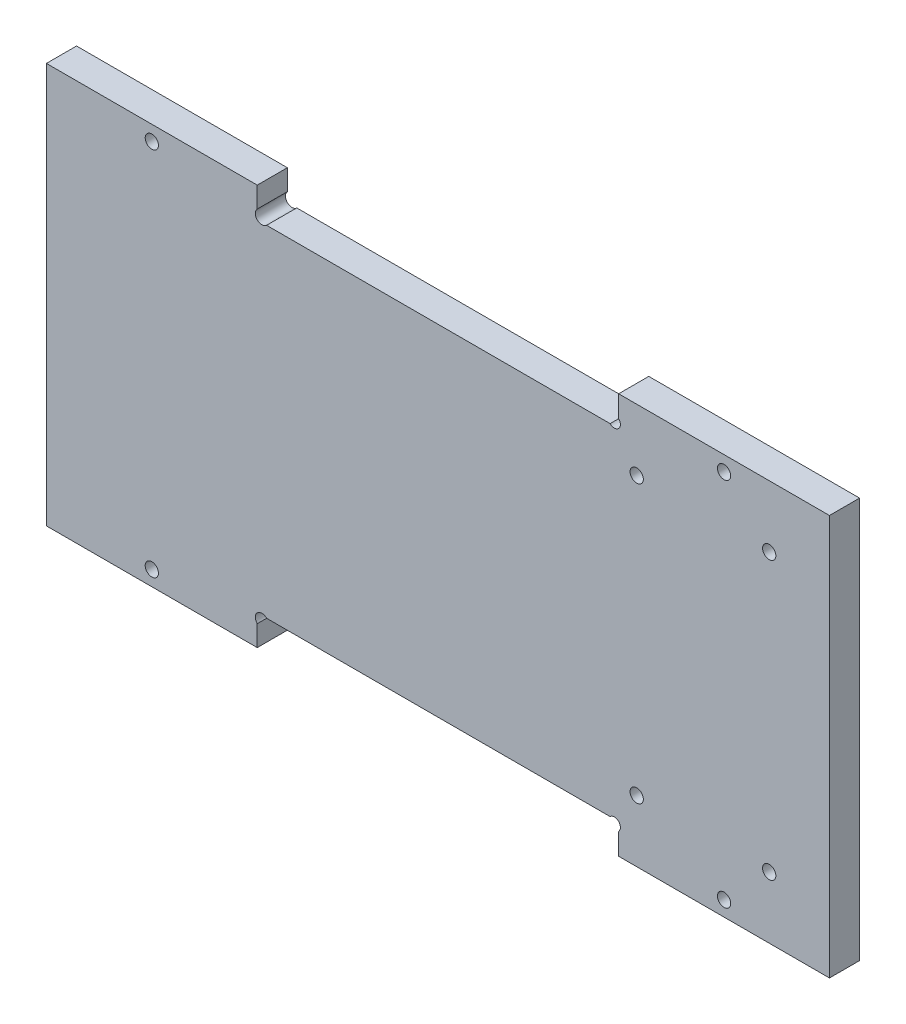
SolidWorks part; units mm, degrees
ref_plane "Plan de face" through (0, 0, 0) normal (0, 0, 1) x (1, 0, 0)
ref_plane "Plan de dessus" through (0, 0, 0) normal (0, 1, 0) x (1, 0, 0)
ref_plane "Plan de droite" through (0, 0, 0) normal (1, 0, 0) x (0, 0, -1)
sketch "Esquisse1" plane through (0, 0, 0) normal (0, 0, 1) x (1, 0, 0)
  line L1 (0, 0) -> (130, 0)
  line L2 (0, 0) -> (0, 66.5)
  line L3 (0, 66.5) -> (130, 66.5)
  line L4 (130, 0) -> (130, 66.5)
  dimension "D1" = 66.5
  dimension "D2" = 130
extrude "Boss.-Extru.1" add sketch "Esquisse1" along normal blind 5
sketch "Esquisse2" plane through (0, 0, 5) normal (0, 0, 1) x (1, 0, 0)
  line L0 (130, 66.5) -> (0, 66.5) construction
  line L1 (0, 66.5) -> (0, 0) construction
  line L3 (5.5, 51.25) -> (81, 51.25) construction
  line L4 (3.5, 15.25) -> (83, 15.25) construction
  circle A0 centre (81, 51.25) radius 1.1
  circle A1 centre (3.5, 15.25) radius 1.1
  circle A2 centre (83, 15.25) radius 1.1
  point P10 (5.5, 51.25)
  dimension "D1" = 2.2
  dimension "D4" = 36
  dimension "D5" = 79.5
  dimension "D6" = 2.2
  dimension "D7" = 2.2
  dimension "D2" = 15.25
  dimension "D3" = 75.5
  dimension "D8" = 81
  dimension "D9" = 3.5
extrude "Enlèv. mat.-Extru.1" [suppressed] cut sketch "Esquisse2" against normal up to next
sketch "Esquisse3" plane through (0, 0, 5) normal (0, 0, 1) x (1, 0, 0)
  line L0 (130, 66.5) -> (0, 66.5) construction
  line L2 (130, 0) -> (130, 66.5) construction
  circle A0 centre (120, 56.25) radius 1.1
  circle A1 centre (120, 10.25) radius 1.1
  circle A2 centre (98, 10.25) radius 1.1
  circle A3 centre (98, 56.25) radius 1.1
  dimension "D1" = 2.2
  dimension "D2" = 2.2
  dimension "D3" = 2.2
  dimension "D4" = 2.2
  dimension "D5" = 22
  dimension "D6" = 46
  dimension "D7" = 10.25
  dimension "D8" = 10
extrude "Enlèv. mat.-Extru.2" cut sketch "Esquisse3" against normal up to next
sketch "Esquisse4" [suppressed] plane through (0, 0, 0) normal (0, 0, -1) x (-1, 0, 0)
  circle A0 centre (-3.5, 15.25) radius 2
  circle A1 centre (-81, 51.25) radius 2
  circle A2 centre (-83, 15.25) radius 2
  dimension "D1" = 4
  dimension "D2" = 4
  dimension "D3" = 4
extrude "Enlèv. mat.-Extru.3" [suppressed] cut sketch "Esquisse4" against normal blind 1.5
sketch "Esquisse6" plane through (0, 0, 0) normal (0, 0, -1) x (-1, 0, 0)
  line L0 (-65, 0) -> (-65, 66.5) construction
  line L1 (0, 0) -> (-130, 0) construction
  line L2 (-130, 66.5) -> (0, 66.5) construction
  line L4 (-35, 0) -> (-95, 0)
  line L5 (-35, 0) -> (-35, 5)
  line L6 (-35, 5) -> (-95, 5)
  line L7 (-95, 0) -> (-95, 5)
  point P10 (-65, 0)
  dimension "D1" = 5
  dimension "D2" = 60
extrude "Enlèv. mat.-Extru.4" cut sketch "Esquisse6" against normal up to next
sketch "Esquisse7" plane through (0, 0, 0) normal (0, 0, -1) x (-1, 0, 0)
  line L0 (-95, 5) -> (-79.5907, -10.4093) construction
  line L1 (-35, 5) -> (-55.2795, -15.2795) construction
  line L2 (-35, 5) -> (-95, 5) construction
  circle A0 centre (-94.2929, 4.2929) radius 1
  circle A1 centre (-35.7778, 4.2222) radius 1.1
  dimension "D3" = 2
  dimension "D4" = 2.2
  dimension "D1" = 45
  dimension "D2" = 45
extrude "Enlèv. mat.-Extru.5" cut sketch "Esquisse7" against normal up to next
ref_plane "Plan1" through (0, 33.25, 0) normal (0, -1, 0) x (1, 0, 0)
mirror "Symétrie1" about plane through (0, 33.25, 0) normal (0, -1, 0) of "Enlèv. mat.-Extru.5", "Enlèv. mat.-Extru.4"
ref_plane "Plan2" through (65, 0, 0) normal (-1, 0, 0) x (0, 0, 1)
sketch "Esquisse8" plane through (0, 0, 0) normal (0, 0, -1) x (-1, 0, 0)
  line L0 (-112.5, 0) -> (-112.5, 23.1606) construction
  line L1 (-95, 0) -> (-130, 0) construction
  circle A0 centre (-112.5, 2.5) radius 1.1
  dimension "D1" = 2.2
  dimension "D2" = 2.5
extrude "Enlèv. mat.-Extru.6" cut sketch "Esquisse8" against normal up to next
mirror "Symétrie2" about plane through (65, 0, 0) normal (-1, 0, 0) of "Enlèv. mat.-Extru.6"
mirror "Symétrie3" about plane through (0, 33.25, 0) normal (0, -1, 0) of "Symétrie2", "Enlèv. mat.-Extru.6"
